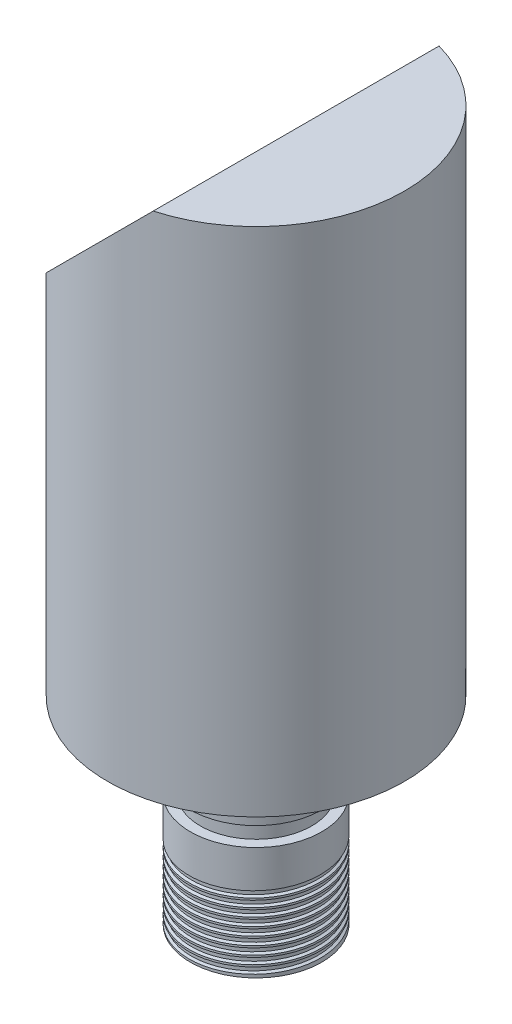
SolidWorks part; units mm, degrees
ref_plane "Front Plane" through (0, 0, 0) normal (0, 0, 1) x (1, 0, 0)
ref_plane "Top Plane" through (0, 0, 0) normal (0, 1, 0) x (1, 0, 0)
ref_plane "Right Plane" through (0, 0, 0) normal (1, 0, 0) x (0, 0, -1)
sketch "Sketch1" plane through (0, 0, 0) normal (0, 0, 1) x (1, 0, 0)
  line L0 (0, 0) -> (0, 109.0359) construction
  line L1 (0, 62) -> (0, -24)
  line L2 (0, 62) -> (-18, 62)
  line L3 (-18, 62) -> (-18, 0)
  line L4 (-18, 0) -> (-7.97, 0)
  line L5 (-7.97, 0) -> (-7.97, -4)
  line L6 (-7.97, -4) -> (-6.75, -4)
  line L7 (-6.75, -4) -> (-6.75, -6.3)
  line L8 (-6.75, -6.3) -> (-7.97, -6.3)
  line L9 (-7.97, -6.3) -> (-7.97, -8)
  line L10 (-7.97, -8) -> (-6.75, -8)
  line L11 (-6.75, -8) -> (-6.75, -10.3)
  line L12 (-6.75, -10.3) -> (-7.97, -10.3)
  line L13 (-7.97, -10.3) -> (-7.97, -24)
  line L14 (-7.97, -24) -> (0, -24)
  dimension "D1" = 62
  dimension "D2" = 36
  dimension "D3" = 15.94
  dimension "D4" = 2.3
  dimension "D5" = 2.3
  dimension "D6" = 1.7
  dimension "D7" = 24
  dimension "D8" = 20
  dimension "D10" = 13.5
revolve "Revolve1" add sketch "Sketch1" angle 360 about L0
sketch "Sketch2" plane through (0, 0, 0) normal (0, 0, 1) x (1, 0, 0)
  line L0 (4.86, 62) -> (-18, 39.14)
  line L1 (18, 62) -> (-18, 62) construction
  line L2 (-18, 39.14) -> (-18, 62)
  line L3 (-18, 62) -> (4.86, 62)
  dimension "D1" = 45
  dimension "D2" = 22.86
extrude "Cut-Extrude1" cut sketch "Sketch2" against normal mid plane 76.2
sketch "Sketch3" plane through (0, -24, 0) normal (0, -1, 0) x (1, 0, 0)
  circle A0 centre (0, 0) radius 8
curve "Helix/Spiral1"
sketch "Sketch4" plane through (0, 0, 0) normal (0, 0, 1) x (1, 0, 0)
  line L0 (-8, -24) -> (-7.6904, -23.8213)
  line L1 (-7.6904, -23.8213) -> (-7.6904, -23.3787)
  line L2 (-7.6904, -23.3787) -> (-8, -23.2)
  line L3 (-7.6904, -23.6) -> (-8.281, -23.6) construction
  line L4 (-7.97, -24) -> (7.97, -24) construction
  line L6 (-8, -23.2) -> (-8, -24)
  spline S0 degree 3 number of poles 147 (-8, -24) -> (-8, -15) construction
  dimension "D1" = 60
  dimension "D2" = 0.8
sweep "Cut-Sweep3" cut profiles "Sketch4" path "Helix/Spiral1"
hole_wizard "Ø3.8 (3.8) Diameter Hole1" positions "Sketch7" profile "Sketch6" hole size "Ø3.8" standard "ANSI Metric"
sketch "Sketch7" plane through (0, 0, 0) normal (0, -1, 0) x (-1, 0, 0)
  point P0 (11, 0)
  dimension "D1" = 11
sketch "Sketch6" plane through (-11, 0, 0) normal (1, 0, 0) x (0, 0, -1)
  line L0 (0, 0) -> (0, 1.6496)
  line L1 (0, 1.6496) -> (1.9, 0.508)
  line L2 (1.9, 0.508) -> (1.9, 0)
  line L5 (1.9, 0) -> (0, 0)
  line L10 (0, 1.6496) -> (-1.9, 0.508) construction
  line L11 (0, -6.35) -> (0, 107.95) construction
  dimension "Hole Dia." = 3.8
  dimension "Hole Depth" = 0.508
  dimension "Drill Angle" = 118
sketch "Sketch8" plane through (0, -24, 0) normal (0, -1, 0) x (1, 0, 0)
  line L0 (-5.5925, 1.016) -> (5.5925, 1.016)
  circle A0 centre (0, 0) radius 7.208
  arc A1 (5.5925, 1.016) -> (-5.5925, 1.016) centre (0, 0) ccw
  circle A2 centre (0, 0) radius 7.97 construction
  dimension "D1" = 1.524
  dimension "D2" = 0.762
  dimension "D3" = 1.016
extrude "Cut-Extrude2" cut sketch "Sketch8" against normal blind 12.7
